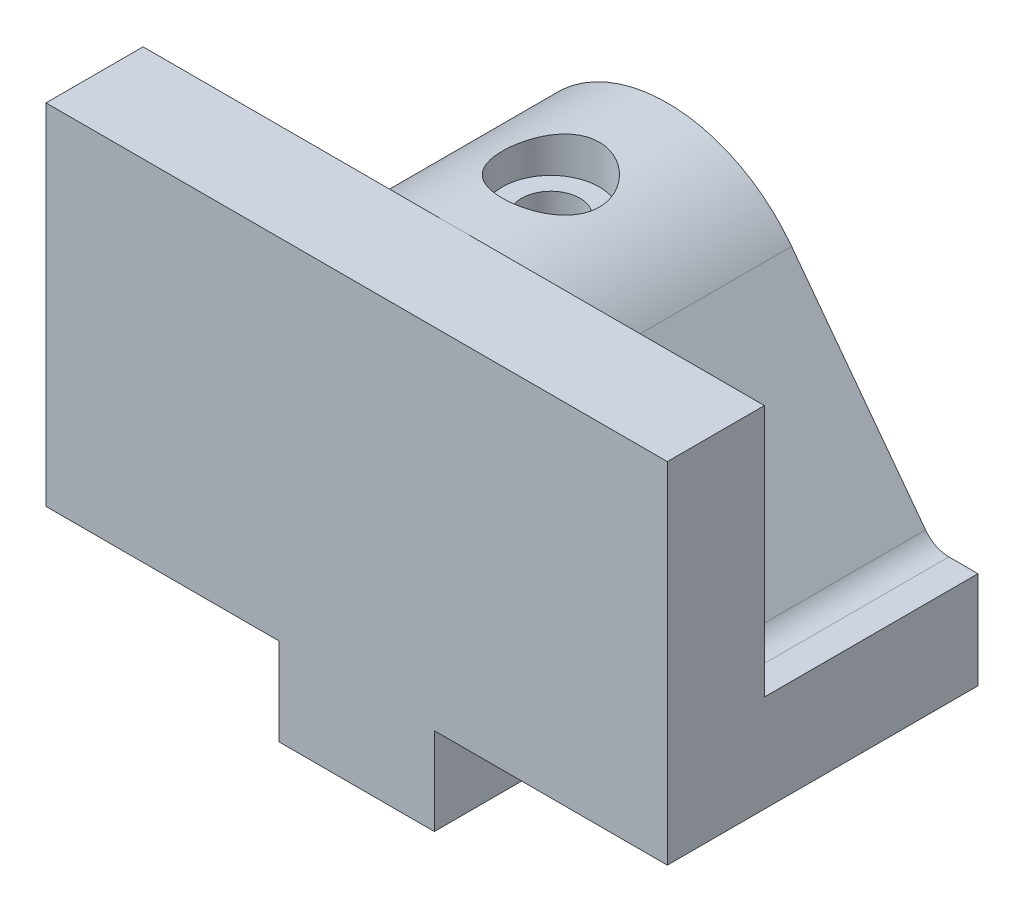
SolidWorks part; units mm, degrees
other "<vice-jaw>-<LPattern1>"
ref_plane "Front Plane" through (0, 0, 0) normal (0, 0, 1) x (1, 0, 0)
ref_plane "Top Plane" through (0, 0, 0) normal (0, 1, 0) x (1, 0, 0)
ref_plane "Right Plane" through (0, 0, 0) normal (1, 0, 0) x (0, 0, -1)
mirrored part "vice-jaw_Mirrored"
